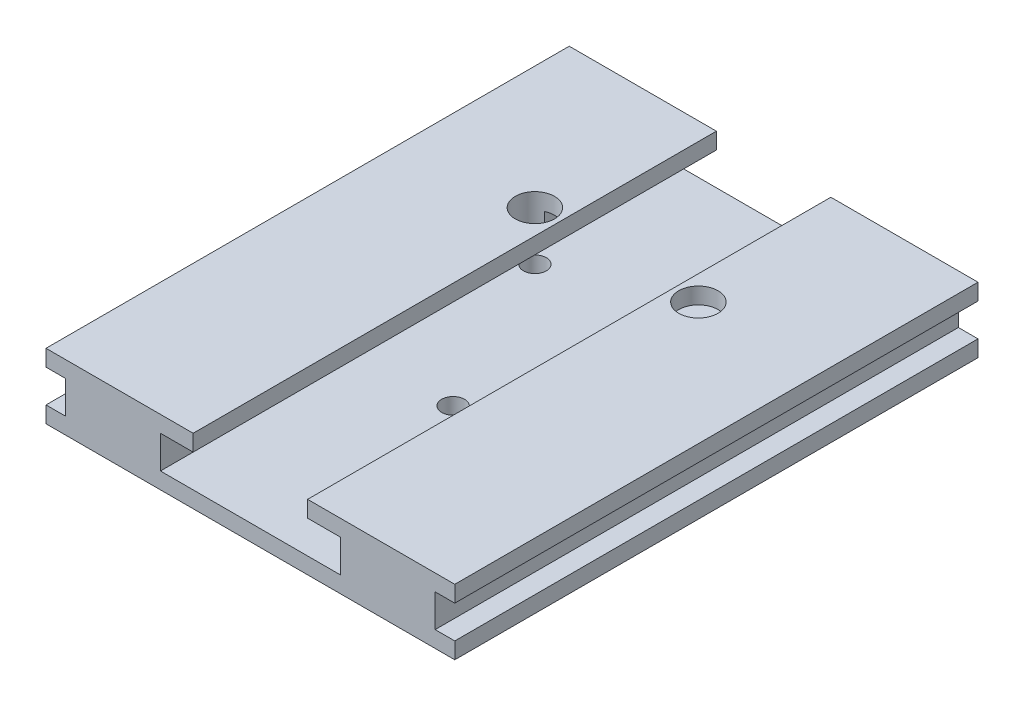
SolidWorks part; units mm, degrees
ref_plane "Face" through (0, 0, 0) normal (0, 0, 1) x (1, 0, 0)
ref_plane "Dessus" through (0, 0, 0) normal (0, 1, 0) x (1, 0, 0)
ref_plane "Droite" through (0, 0, 0) normal (1, 0, 0) x (0, 0, -1)
sketch "Esquisse1" plane through (0, 0, 0) normal (0, 0, 1) x (1, 0, 0)
  line L1 (-46.2088, -47.1775) -> (78.7912, -47.1775)
  line L2 (-46.2088, -47.1775) -> (-46.2088, -67.1775)
  line L3 (-46.2088, -67.1775) -> (78.7912, -67.1775)
  line L4 (78.7912, -47.1775) -> (78.7912, -67.1775)
  dimension "D1" = 125
  dimension "D2" = 20
extrude "Extrusion1" add sketch "Esquisse1" along normal blind 360
sketch "Esquisse2" plane through (0, 0, 360) normal (0, 0, 1) x (1, 0, 0)
  line L1 (78.7912, -52.1775) -> (72.7912, -52.1775)
  line L2 (78.7912, -52.1775) -> (78.7912, -62.1775)
  line L3 (78.7912, -62.1775) -> (72.7912, -62.1775)
  line L4 (72.7912, -52.1775) -> (72.7912, -62.1775)
  line L5 (78.7912, -67.1775) -> (78.7912, -47.1775) construction
  line L6 (-46.2088, -67.1775) -> (78.7912, -67.1775) construction
  line L8 (78.7912, -47.1775) -> (-46.2088, -47.1775) construction
  line L9 (-46.2088, -52.1775) -> (-40.2088, -52.1775)
  line L10 (-46.2088, -52.1775) -> (-46.2088, -62.1775)
  line L11 (-46.2088, -62.1775) -> (-40.2088, -62.1775)
  line L12 (-40.2088, -52.1775) -> (-40.2088, -62.1775)
  line L13 (-46.2088, -47.1775) -> (-46.2088, -67.1775) construction
  line L14 (33.7912, -52.1775) -> (43.7912, -52.1775)
  line L15 (-1.2088, -47.1775) -> (33.7912, -47.1775)
  line L16 (-1.2088, -47.1775) -> (-1.2088, -52.1775)
  line L18 (33.7912, -47.1775) -> (33.7912, -52.1775)
  line L19 (43.7912, -52.1775) -> (43.7912, -62.1775)
  line L20 (43.7912, -62.1775) -> (-11.2088, -62.1775)
  line L21 (-11.2088, -62.1775) -> (-11.2088, -52.1775)
  line L22 (-11.2088, -52.1775) -> (-1.2088, -52.1775)
  dimension "D1" = 10
  dimension "D2" = 6
  dimension "D3" = 6
  dimension "D4" = 5
  dimension "D5" = 6
  dimension "D6" = 10
  dimension "D7" = 5
  dimension "D8" = 35
  dimension "D9" = 10
  dimension "D10" = 10
  dimension "D11" = 10
  dimension "D12" = 5
  dimension "D13" = 10
  dimension "D14" = 45
extrude "Enlèv. mat.-Extru.1" cut sketch "Esquisse2" against normal through all
sketch "Esquisse4" plane through (0, -67.1775, 0) normal (0, -1, 0) x (1, 0, 0)
  line L0 (-46.2088, 360) -> (78.7912, 360) construction
  line L1 (78.7912, 360) -> (78.7912, 0) construction
  circle A0 centre (41.2912, 248) radius 3.5
  circle A1 centre (-8.7088, 248) radius 3.5
  circle A2 centre (16.2912, 298) radius 3.5
  dimension "D1" = 7
  dimension "D2" = 7
  dimension "D6" = 7
  dimension "D7" = 50
  dimension "D8" = 25
  dimension "D3" = 112
  dimension "D4" = 37.5
  dimension "D5" = 50
extrude "Enlèv. mat.-Extru.3" cut sketch "Esquisse4" against normal through all
sketch "Esquisse5" plane through (0, -47.1775, 0) normal (0, 1, 0) x (1, 0, 0)
  line L1 (-46.2088, 0) -> (94.2308, 0)
  line L2 (-46.2088, 0) -> (-46.2088, -200)
  line L3 (-46.2088, -200) -> (94.2308, -200)
  line L4 (94.2308, 0) -> (94.2308, -200)
  dimension "D1" = 200
extrude "Enlèv. mat.-Extru.4" cut sketch "Esquisse5" against normal through all
sketch "Esquisse6" plane through (0, -47.1775, 0) normal (0, 1, 0) x (1, 0, 0)
  circle A0 centre (41.2912, -248) radius 6
  circle A1 centre (-8.7088, -248) radius 6
  dimension "D1" = 12
  dimension "D2" = 12
extrude "Enlèv. mat.-Extru.5" cut sketch "Esquisse6" against normal blind 15
